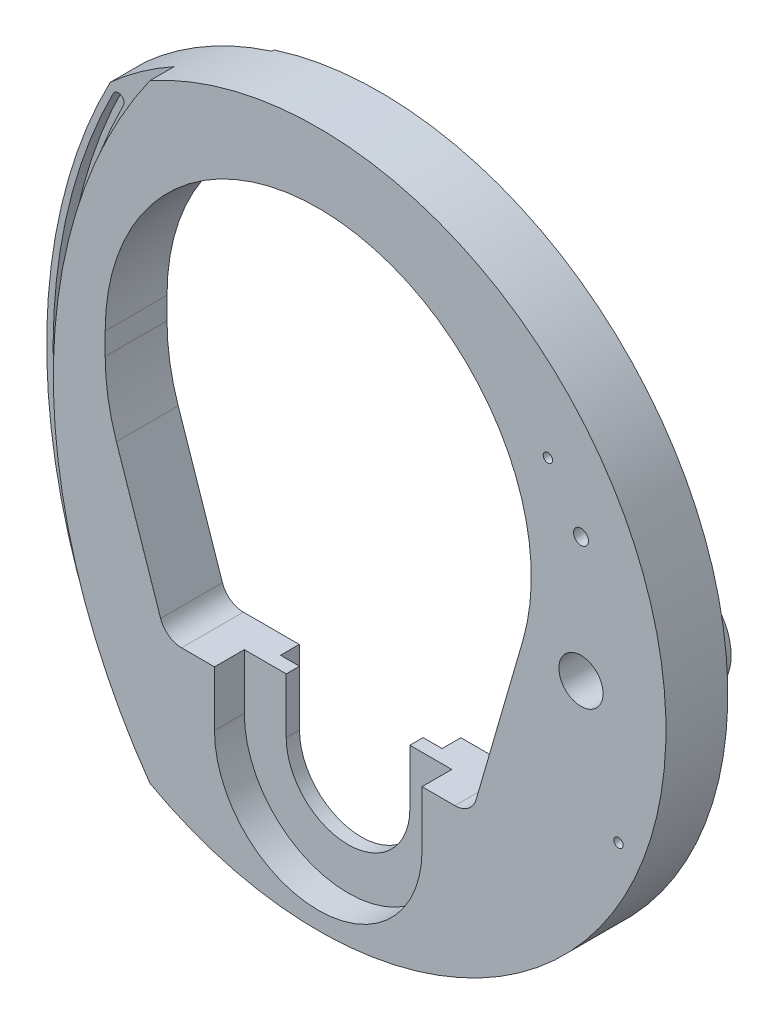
SolidWorks part; units mm, degrees
ref_plane "Plan1" through (0, 0, 0) normal (0, 0, 1) x (1, 0, 0)
ref_plane "Plan2" through (0, 0, 0) normal (0, 1, 0) x (1, 0, 0)
ref_plane "Plan3" through (0, 0, 0) normal (1, 0, 0) x (0, 0, -1)
sketch "Esquisse1" plane through (0, 0, 0) normal (0, 0, 1) x (1, 0, 0)
  line L0 (-28, -107) -> (-61.915, -107)
  line L1 (-28, -107) -> (-28, -132)
  line L2 (61.915, -107) -> (28, -107)
  line L3 (28, -107) -> (28, -132)
  line L4 (92.675, -26.8998) -> (71.5186, -99.7875)
  line L5 (-96.5, 0) -> (-96.5, -10)
  line L6 (0, 0) -> (0, -201.0716) construction
  line L7 (0, -29.5) -> (119, -29.5) construction
  line L8 (-91.4255, -40.8809) -> (-71.3891, -100.2001)
  arc A0 (-105.2174, -146.6987) -> (-105.2174, 87.6987) centre (0, -29.5) ccw
  arc A1 (-28, -132) -> (28, -132) centre (0, -132) ccw
  circle A2 centre (119, -29.5) radius 10
  arc A3 (-105.2174, 87.6987) -> (-105.2174, -146.6987) centre (119, -29.5) ccw
  arc A4 (92.675, -26.8998) -> (-96.5, 0) centre (0, 0) ccw
  arc A5 (-61.915, -107) -> (-71.3891, -100.2001) centre (-61.915, -97) cw
  arc A6 (71.5186, -99.7875) -> (61.915, -107) centre (61.915, -97) cw
  arc A7 (-96.5, -10) -> (-91.4255, -40.8809) centre (0, -10) ccw
  dimension "D3" = 20
  dimension "D4" = 96.5
  dimension "D5" = 253
  dimension "D6" = 157.5
  dimension "D7" = 97
  dimension "D8" = 10
  dimension "D10" = 132
  dimension "D11" = 28
  dimension "D12" = 61.915
  dimension "D1" = 29.5
  dimension "D2" = 119
  dimension "D9" = 56
  dimension "D13" = 10
extrude "Base-Extrusion" add sketch "Esquisse1" along normal blind 28
sketch "Esquisse9" plane through (0, 0, 0) normal (0, 0, -1) x (-1, 0, 0)
  line L0 (0, 0) -> (0, -207.5971) construction
  line L1 (36.6, -95.9366) -> (36.6, -153.5)
  line L2 (-36.6, -95.9366) -> (-36.6, -153.5)
  line L3 (21.6, -168.5) -> (-21.6, -168.5)
  line L4 (36.6, -95.9366) -> (-36.6, -95.9366)
  line L5 (-28, -107) -> (-61.915, -107) construction
  arc A0 (-21.6, -168.5) -> (-36.6, -153.5) centre (-21.6, -153.5) cw
  arc A1 (21.6, -168.5) -> (36.6, -153.5) centre (21.6, -153.5) ccw
  point P8 (0, -168.5)
  point P9 (0, -95.9366)
  point P13 (-36.6, -168.5)
  point P16 (36.6, -168.5)
  dimension "D3" = 15
  dimension "D1" = 73.2
  dimension "D2" = 61.5
extrude "Enlèv. mat.-Extru.3" cut sketch "Esquisse9" against normal blind 8.5
sketch "Esquisse10" plane through (0, 0, 28) normal (0, 0, 1) x (1, 0, 0)
  line L0 (0, 0) -> (0, -203.5888) construction
  line L1 (-73.3243, -132) -> (70.403, -132) construction
  line L2 (73.3243, -132) -> (-70.403, -132) construction
  line L3 (47, -97.0818) -> (47, -132)
  line L4 (-47, -97.0818) -> (-47, -132)
  line L5 (-47, -97.0818) -> (47, -97.0818)
  arc A0 (47, -132) -> (-47, -132) centre (0, -132) cw
  point P12 (0, -97.0818)
  dimension "D1" = 132
  dimension "D2" = 94
  dimension "D3" = 34.9182
extrude "Enlèv. mat.-Extru.4" cut sketch "Esquisse10" against normal blind 13.5
sketch "Esquisse11" plane through (0, 0, 0) normal (0, 0, -1) x (-1, 0, 0)
  circle A0 centre (-119.0125, -29.4702) radius 24
  circle A1 centre (-119, -29.5) radius 10 construction
  circle A2 centre (-119, -29.5) radius 10
  dimension "D1" = 48
extrude "Boss.-Extru.2" add sketch "Esquisse11" along normal blind 16
fillet "Congé2" radius 2 1 edges at (143.0125, -29.4702, 0)
sketch "Esquisse14" plane through (0, 0, 0) normal (0, 0, -1) x (-1, 0, 0)
  line L0 (40.9812, 128) -> (134, 128)
  line L1 (134, 128) -> (134, -187)
  line L2 (134, -187) -> (40.9812, -187)
  circle A0 centre (-119, -29.5) radius 10 construction
  arc A1 (105.2174, 87.6987) -> (105.2174, -146.6987) centre (0, -29.5) ccw construction
  arc A2 (40.9812, -187) -> (40.9812, 128) centre (-119, -29.5) ccw
  arc A3 (105.2174, -146.6987) -> (105.2174, 87.6987) centre (-119, -29.5) ccw construction
  dimension "D1" = 224.5
extrude "Enlèv. mat.-Extru.5" cut sketch "Esquisse14" against normal blind 1
sketch "Esquisse15" plane through (0, 0, 0) normal (0, 0, -1) x (-1, 0, 0)
  arc A0 (48.0378, -179.4954) -> (48.0378, 120.4954) centre (-119, -29.5) ccw construction
  arc A1 (94.7763, -98.0561) -> (89.7196, 53.1824) centre (-119, -29.5) ccw
  arc A2 (108.5837, -102.484) -> (103.2004, 58.5227) centre (-119, -29.5) ccw
  arc A3 (94.7763, -98.0561) -> (108.5837, -102.484) centre (101.68, -100.2701) ccw
  arc A4 (103.2004, 58.5227) -> (89.7196, 53.1824) centre (96.46, 55.8525) ccw
  circle A5 centre (-119, -29.5) radius 10 construction
  dimension "D1" = 14.5
  dimension "D2" = 220.68
  dimension "D3" = 215.46
  dimension "D4" = 96.46
  dimension "D5" = 101.68
  dimension "D6" = 156.1226
extrude "Enlèv. mat.-Extru.9" cut sketch "Esquisse15" against normal blind 1.5
sketch "Esquisse16" plane through (0, 0, 28) normal (0, 0, 1) x (1, 0, 0)
  line L0 (-59.6738, 129.2346) -> (-150.1348, 125.724)
  line L1 (-150.1348, 125.724) -> (-132.9563, -197.8054)
  line L2 (-132.9563, -197.8054) -> (-50.6888, -197.8054)
  arc A0 (-59.6738, 129.2346) -> (-50.6888, -197.8054) centre (119, -29.5) ccw
  dimension "D1" = 478
extrude "Enlèv. mat.-Extru.10" cut sketch "Esquisse16" against normal blind 11
sketch "Esquisse17" plane through (0, 0, 17) normal (0, 0, 1) x (1, 0, 0)
  arc A0 (-99.2315, 81.6351) -> (-88.2721, -159.9388) centre (119, -29.5) ccw
  arc A1 (-103.8653, 83.9949) -> (-99.0872, -151.9254) centre (119, -29.5) ccw
  arc A2 (-105.2174, -146.6987) -> (-76.2763, -167.2976) centre (0, -29.5) ccw construction
  arc A3 (-99.0872, -151.9254) -> (-88.2721, -159.9388) centre (0, -29.5) ccw
  arc A4 (-103.8653, 83.9949) -> (-99.2315, 81.6351) centre (-101.5484, 82.815) cw
  dimension "D1" = 489.8
  dimension "D2" = 500.2
extrude "Enlèv. mat.-Extru.11" cut sketch "Esquisse17" against normal blind 5
sketch "Esquisse18" plane through (0, 0, 0) normal (0, 0, -1) x (-1, 0, 0)
  line L0 (-28, -132) -> (-28, -107) construction
  line L1 (-21.6, -168.5) -> (21.6, -168.5) construction
  circle A0 centre (43.6, -117) radius 2
  circle A1 centre (-43.6, -117) radius 2
  dimension "D1" = 4
  dimension "D2" = 4
  dimension "D3" = 87.2
  dimension "D4" = 15.6
  dimension "D5" = 51.5
  dimension "D6" = 51.5
extrude "Enlèv. mat.-Extru.12" cut sketch "Esquisse18" against normal blind 4
chamfer "Chanfrein1" distance 1.5 angle 45 2 edges at (-45.6, -117, 0) (41.6, -117, 0)
sketch "Esquisse19" plane through (0, 0, 0) normal (0, 0, -1) x (-1, 0, 0)
  line L2 (-28, -132) -> (-28, -107) construction
  line L3 (-21.6, -168.5) -> (21.6, -168.5) construction
  circle A0 centre (54.6, -132) radius 5.6
  circle A1 centre (-54.6, -132) radius 5.6
  dimension "D5" = 11.2
  dimension "D6" = 11.2
  dimension "D1" = 109.2
  dimension "D2" = 26.6
  dimension "D3" = 36.5
  dimension "D4" = 36.5
extrude "Enlèv. mat.-Extru.13" cut sketch "Esquisse19" against normal blind 16
chamfer "Chanfrein2" distance 0.3 angle 45 2 edges at (-60.2, -132, 0) (49, -132, 0)
hole_wizard "Diamètre du perçage Ø6.7 (6.75)1" positions "Esquisse21" profile "Esquisse20" hole size "Ø6.7" standard "ISO"
sketch "Esquisse21" plane through (0, 0, 0) normal (0, 0, -1) x (-1, 0, 0)
  point P0 (-119, 27)
  dimension "D1" = 27
  dimension "D2" = 119
sketch "Esquisse20" plane through (119, 27, 0) normal (1, 0, 0) x (0, 1, 0)
  line L0 (0, 0) -> (0, 28)
  line L1 (0, 28) -> (3.375, 28)
  line L2 (3.375, 28) -> (3.375, 0)
  line L5 (3.375, 0) -> (0, 0)
  line L11 (0, -6.35) -> (0, 107.95) construction
  dimension "Diamètre du perçage jusqu'au prochain" = 6.75
  dimension "Profondeur du perçage jusqu'au prochain" = 28
thread "Filetage1" pitch 1.25 start angle 0, offset 5, length 35, pitch 1.25, diameter 6.75
ref_plane "Plan4" through (122.375, 27, -5) normal (0, -1, 0) x (1, 0, 0)
sketch "Profil de filetage1" plane through (122.375, 27, -5) normal (0, -1, 0) x (1, 0, 0)
  line L0 (0, 0) -> (0, 1.25) construction
  line L1 (0, 0) -> (0.6766, 0.3906)
  line L2 (0.6766, 0.3906) -> (0.6766, 0.5469)
  line L3 (0.6766, 0.5469) -> (0, 0.9375)
  line L4 (0.6766, 0.4687) -> (0, 0.4687) construction
  line L11 (0, 0) -> (0, 0.9375)
  point P2 (0, 0)
  dimension "Pitch" = 1.25
  dimension "Profile_Angle" = 60
  dimension "Profile_Land" = 0.1562
  dimension "Profile_Height" = 0.6766
hole_wizard "Diamètre du perçage Ø4.2 (4.2)1" positions "Esquisse23" profile "Esquisse22" hole size "Ø4.2" standard "ISO"
sketch "Esquisse23" plane through (0, 0, 28) normal (0, 0, 1) x (1, 0, 0)
  circle A0 centre (119, -29.5) radius 10 construction
  circle A1 centre (119, 27) radius 3.375 construction
  point P0 (104, 50.5)
  point P1 (136, -84.5)
  dimension "D2" = 15
  dimension "D3" = 17
  dimension "D1" = 80
  dimension "D4" = 55
sketch "Esquisse22" plane through (104, 50.5, 28) normal (1, 0, 0) x (0, -1, 0)
  line L0 (0, 0) -> (0, 15.2618)
  line L1 (0, 15.2618) -> (2.1, 14)
  line L2 (2.1, 14) -> (2.1, 0)
  line L5 (2.1, 0) -> (0, 0)
  line L10 (0, 15.2618) -> (-2.1, 14) construction
  line L11 (0, -6.35) -> (0, 107.95) construction
  dimension "Diamètre du perçage" = 4.2
  dimension "Profondeur du perçage" = 14
  dimension "Angle de pointe" = 118
thread "Filetage2" pitch 0.8 start angle 0, offset 5, length 15, pitch 0.8, diameter 4.2
ref_plane "Plan5" through (101.9, 50.5, 33) normal (0, -1, 0) x (-1, 0, 0)
sketch "Profil de filetage2" plane through (101.9, 50.5, 33) normal (0, -1, 0) x (-1, 0, 0)
  line L0 (0, 0) -> (0, 0.8) construction
  line L1 (0, 0) -> (0.433, 0.25)
  line L2 (0.433, 0.25) -> (0.433, 0.35)
  line L3 (0.433, 0.35) -> (0, 0.6)
  line L4 (0.433, 0.3) -> (0, 0.3) construction
  line L11 (0, 0) -> (0, 0.6)
  point P2 (0, 0)
  dimension "Pitch" = 0.8
  dimension "Profile_Angle" = 60
  dimension "Profile_Land" = 0.1
  dimension "Profile_Height" = 0.433
thread "Filetage3" pitch 0.8 start angle 0, offset 5, length 15, pitch 0.8, diameter 4.2
ref_plane "Plan6" through (133.9, -84.5, 33) normal (0, -1, 0) x (-1, 0, 0)
sketch "Profil de filetage3" plane through (133.9, -84.5, 33) normal (0, -1, 0) x (-1, 0, 0)
  line L0 (0, 0) -> (0, 0.8) construction
  line L1 (0, 0) -> (0.433, 0.25)
  line L2 (0.433, 0.25) -> (0.433, 0.35)
  line L3 (0.433, 0.35) -> (0, 0.6)
  line L4 (0.433, 0.3) -> (0, 0.3) construction
  line L11 (0, 0) -> (0, 0.6)
  point P2 (0, 0)
  dimension "Pitch" = 0.8
  dimension "Profile_Angle" = 60
  dimension "Profile_Land" = 0.1
  dimension "Profile_Height" = 0.433
hole_wizard "Diamètre du perçage Ø4.0 (4)1" positions "Esquisse25" profile "Esquisse24" hole size "Ø4.0" standard "Ansi Metric"
sketch "Esquisse25" plane through (0, 0, 0) normal (0, 0, -1) x (-1, 0, 0)
  point P1 (-43.6, -117)
  point P4 (43.6, -117)
sketch "Esquisse24" plane through (43.6, -117, 0) normal (1, 0, 0) x (0, 1, 0)
  line L0 (0, 0) -> (0, 14.2017)
  line L1 (0, 14.2017) -> (2, 13)
  line L2 (2, 13) -> (2, 0)
  line L5 (2, 0) -> (0, 0)
  line L10 (0, 14.2017) -> (-2, 13) construction
  line L11 (0, -6.35) -> (0, 107.95) construction
  dimension "Diamètre du perçage" = 4
  dimension "Profondeur du perçage" = 13
  dimension "Angle de pointe" = 118
sketch "Esquisse26" plane through (0, 0, 0) normal (0, 0, -1) x (-1, 0, 0)
  line L0 (0, 0) -> (0, 48.3264) construction
  line L1 (-25, 122.5) -> (25, 122.5)
  line L2 (-27, 120.5) -> (-27, 102)
  line L3 (-25, 100) -> (25, 100)
  line L4 (27, 120.5) -> (27, 102)
  arc A0 (-25, 122.5) -> (-27, 120.5) centre (-25, 120.5) ccw
  arc A1 (27, 120.5) -> (25, 122.5) centre (25, 120.5) ccw
  arc A2 (25, 100) -> (27, 102) centre (25, 102) ccw
  arc A3 (-27, 102) -> (-25, 100) centre (-25, 102) ccw
  point P9 (-27, 122.5)
  point P12 (27, 122.5)
  point P15 (27, 100)
  dimension "D4" = 2
  dimension "D1" = 54
  dimension "D2" = 22.5
  dimension "D3" = 100
extrude "Extrusion1" cut sketch "Esquisse26" against normal blind 2
